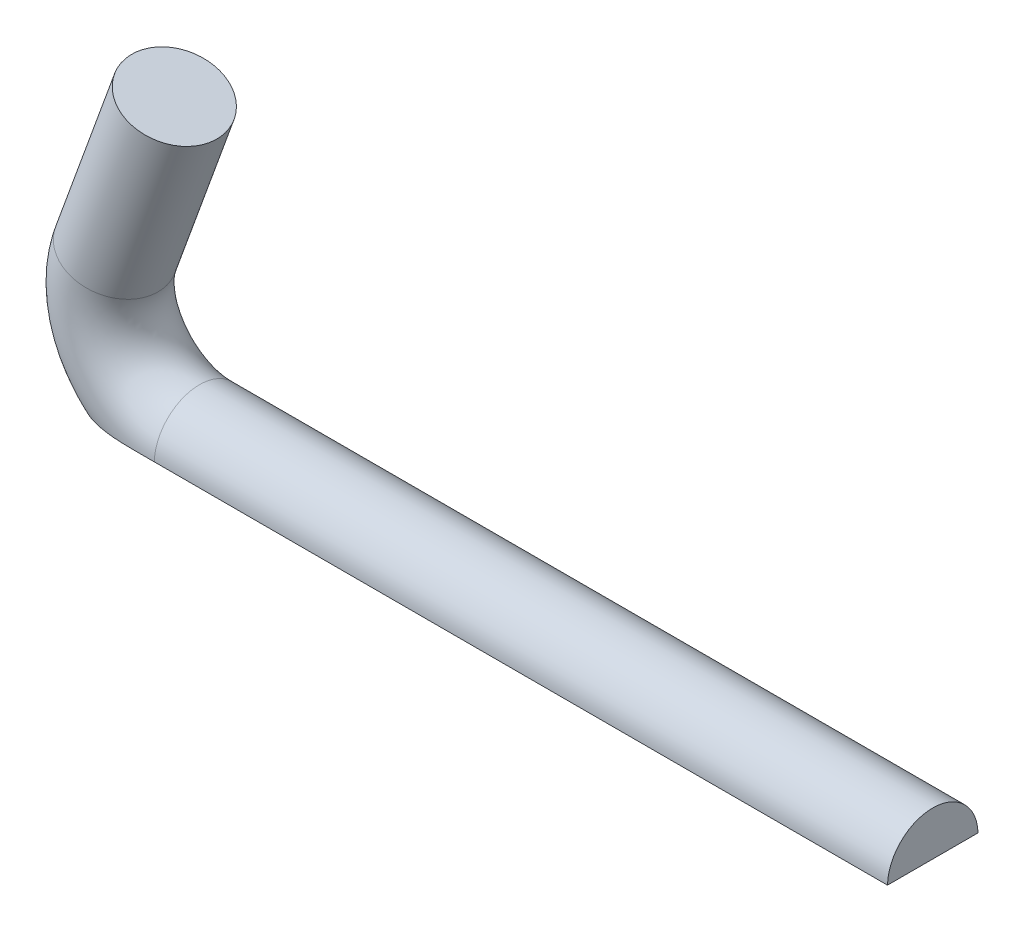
SolidWorks part; units mm, degrees
ref_plane "Front Plane" through (0, 0, 0) normal (0, 0, 1) x (1, 0, 0)
ref_plane "Top Plane" through (0, 0, 0) normal (0, 1, 0) x (1, 0, 0)
ref_plane "Right Plane" through (0, 0, 0) normal (1, 0, 0) x (0, 0, -1)
sketch "Sketch1" plane through (0, 0, 0) normal (0, 0, 1) x (1, 0, 0)
  line L0 (0, 0) -> (-18.924, 0)
  line L1 (-21.096, 3.1019) -> (-19.5754, 7.2798)
  arc A0 (-18.924, 0) -> (-21.096, 3.1019) centre (-18.924, 2.3114) cw
  point P6 (-22.225, 0)
  dimension "D4" = 2.3114
  dimension "D1" = 70
  dimension "D2" = 7.747
  dimension "D3" = 22.225
sketch "Sketch2" plane through (0, 0, 0) normal (1, 0, 0) x (0, 0, -1)
  circle A0 centre (0, 0) radius 1.1684
  dimension "D1" = 2.3368
sweep "Sweep1" add profiles "Sketch2" path "Sketch1"
sketch "Sketch3" plane through (0, 0, 0) normal (0, 0, 1) x (1, 0, 0)
  line L0 (0, -1.1684) -> (0, 1.1684) construction
  line L1 (0, 0.0254) -> (-21.844, 0.0254)
  line L2 (0, 0.0254) -> (0, -1.4986)
  line L3 (0, -1.4986) -> (-21.844, -1.4986)
  line L4 (-21.844, 0.0254) -> (-21.844, -1.4986)
  line L5 (0, 1.1684) -> (-18.924, 1.1684) construction
  dimension "D1" = 1.143
  dimension "D2" = 1.524
  dimension "D3" = 21.844
extrude "Cut-Extrude1" cut sketch "Sketch3" against normal through all both and the other way through all
